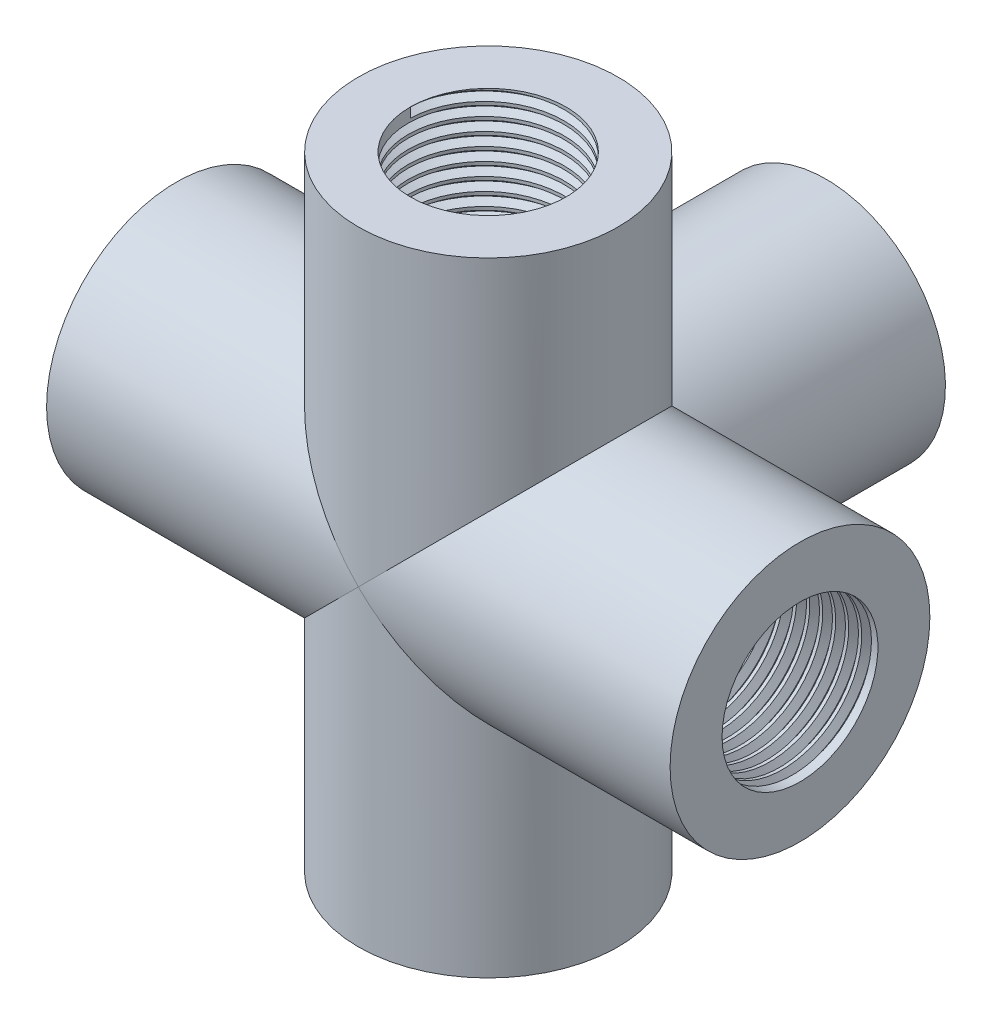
SolidWorks part; units mm, degrees
ref_plane "Front Plane" through (0, 0, 0) normal (0, 0, 1) x (1, 0, 0)
ref_plane "Top Plane" through (0, 0, 0) normal (0, 1, 0) x (1, 0, 0)
ref_plane "Right Plane" through (0, 0, 0) normal (1, 0, 0) x (0, 0, -1)
sketch "Cross Connector  " plane through (0, 0, 0) normal (1, 0, 0) x (0, 0, -1)
  circle A0 centre (0, 0) radius 15.875
  dimension "D1" = 31.75
extrude "Cross Connector (Horizontal)" add sketch "Cross Connector  " along normal blind 76.2
sketch "Horizontal Opening" plane through (0, 0, 0) normal (1, 0, 0) x (0, 0, -1)
  circle A0 centre (0, 0) radius 9.525
  dimension "D1" = 19.05
extrude "Interior (Horizontal)" cut sketch "Horizontal Opening" along normal blind 76.2
sketch "Length of Part" plane through (0, 0, 0) normal (0, 0, 1) x (1, 0, 0)
  line L0 (0, 0) -> (76.2, 0) construction
  line L1 (76.2, -15.875) -> (76.2, 15.875) construction
sketch "Cross Connector" plane through (0, 0, 0) normal (0, 1, 0) x (1, 0, 0)
  line L0 (0, 0) -> (76.2, 0) construction
  circle A0 centre (38.1, 0) radius 15.875
  dimension "D1" = 31.75
extrude "Cross Connector (Vertical)" add sketch "Cross Connector" along normal mid plane 76.2
sketch "Vertical Opening" plane through (0, 0, 0) normal (0, 1, 0) x (1, 0, 0)
  line L0 (0, 0) -> (76.2, 0) construction
  circle A0 centre (38.1, 0) radius 9.525
  dimension "D1" = 19.05
extrude "Interior (Vertical)" cut sketch "Vertical Opening" against normal mid plane 107.95
sketch "Sketch1" plane through (76.2, 0, 0) normal (1, 0, 0) x (0, 0, -1)
  circle A0 centre (0, 0) radius 9.525
  dimension "D1" = 19.05
extrude "Cut Through" cut sketch "Sketch1" against normal blind 127
ref_plane "Plane" through (0, 0, -15.875) normal (0, 0, -1) x (-1, 0, 0)
sketch "Sketch2" plane through (0, 0, -15.875) normal (0, 0, -1) x (-1, 0, 0)
  circle A0 centre (-38.1, 0) radius 14.605
  dimension "D1" = 29.21
extrude "Boss-Extrude1" add sketch "Sketch2" along normal mid plane 11.43 separate body
sketch "Sketch4" plane through (0, 0, -15.875) normal (0, 0, -1) x (-1, 0, 0)
  circle A0 centre (-38.1, 0) radius 14.605
  dimension "D1" = 29.21
extrude "Boss-Extrude2" add sketch "Sketch4" along normal blind 25.4
thread "Thread1" pitch 1.5875 start angle 0, offset 0, length 19.05, pitch 1.5875, diameter 19.05
ref_plane "Plane1" through (28.575, 38.1, 0) normal (0, 0, 1) x (-1, 0, 0)
sketch "Thread Profile1" plane through (28.575, 38.1, 0) normal (0, 0, 1) x (-1, 0, 0)
  line L0 (0, 0) -> (0, 1.5875) construction
  line L1 (0, 0) -> (0.8593, 0.4961)
  line L2 (0.8593, 0.4961) -> (0.8593, 0.6945)
  line L3 (0.8593, 0.6945) -> (0, 1.1906)
  line L4 (0.8593, 0.5953) -> (0, 0.5953) construction
  line L11 (0, 0) -> (0, 1.1906)
  point P2 (0, 0)
  dimension "Pitch" = 1.5875
  dimension "Profile_Angle" = 60
  dimension "Profile_Land" = 0.1984
  dimension "Profile_Height" = 0.8593
thread "Thread2" pitch 1.5875 start angle 0, offset 0, length 19.05, pitch 1.5875, diameter 19.05
ref_plane "Plane2" through (0, 0, -9.525) normal (0, -1, 0) x (0, 0, -1)
sketch "Thread Profile2" plane through (0, 0, -9.525) normal (0, -1, 0) x (0, 0, -1)
  line L0 (0, 0) -> (0, 1.5875) construction
  line L1 (0, 0) -> (0.8593, 0.4961)
  line L2 (0.8593, 0.4961) -> (0.8593, 0.6945)
  line L3 (0.8593, 0.6945) -> (0, 1.1906)
  line L4 (0.8593, 0.5953) -> (0, 0.5953) construction
  line L11 (0, 0) -> (0, 1.1906)
  point P2 (0, 0)
  dimension "Pitch" = 1.5875
  dimension "Profile_Angle" = 60
  dimension "Profile_Land" = 0.1984
  dimension "Profile_Height" = 0.8593
thread "Thread3" pitch 1.5875 start angle 0, offset 0, length 19.05, pitch 1.5875, diameter 19.05
ref_plane "Plane3" through (76.2, 0, 9.525) normal (0, -1, 0) x (0, 0, 1)
sketch "Thread Profile3" plane through (76.2, 0, 9.525) normal (0, -1, 0) x (0, 0, 1)
  line L0 (0, 0) -> (0, 1.5875) construction
  line L1 (0, 0) -> (0.8593, 0.4961)
  line L2 (0.8593, 0.4961) -> (0.8593, 0.6945)
  line L3 (0.8593, 0.6945) -> (0, 1.1906)
  line L4 (0.8593, 0.5953) -> (0, 0.5953) construction
  line L11 (0, 0) -> (0, 1.1906)
  point P2 (0, 0)
  dimension "Pitch" = 1.5875
  dimension "Profile_Angle" = 60
  dimension "Profile_Land" = 0.1984
  dimension "Profile_Height" = 0.8593
thread "Thread4" pitch 1.5875 start angle 0, offset 0, length 19.05, pitch 1.5875, diameter 19.05
ref_plane "Plane4" through (47.625, -38.1, 0) normal (0, 0, 1) x (1, 0, 0)
sketch "Thread Profile4" plane through (47.625, -38.1, 0) normal (0, 0, 1) x (1, 0, 0)
  line L0 (0, 0) -> (0, 1.5875) construction
  line L1 (0, 0) -> (0.8593, 0.4961)
  line L2 (0.8593, 0.4961) -> (0.8593, 0.6945)
  line L3 (0.8593, 0.6945) -> (0, 1.1906)
  line L4 (0.8593, 0.5953) -> (0, 0.5953) construction
  line L11 (0, 0) -> (0, 1.1906)
  point P2 (0, 0)
  dimension "Pitch" = 1.5875
  dimension "Profile_Angle" = 60
  dimension "Profile_Land" = 0.1984
  dimension "Profile_Height" = 0.8593
